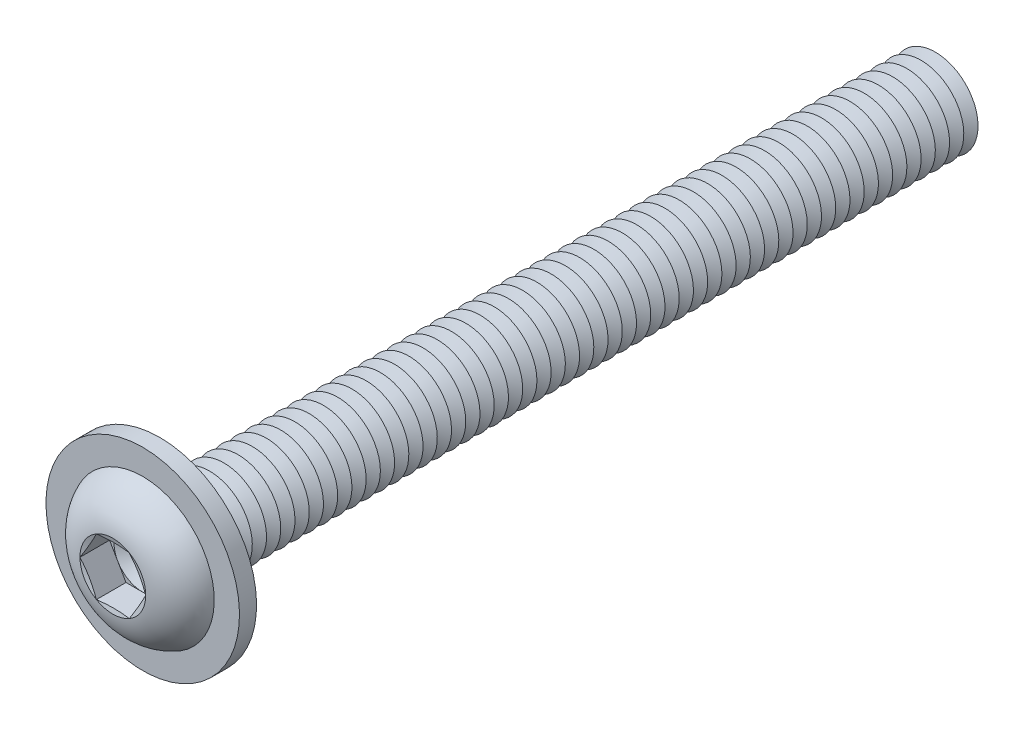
SolidWorks part; units mm, degrees
ref_plane "Front Plane" through (0, 0, 0) normal (0, 0, 1) x (1, 0, 0)
ref_plane "Top Plane" through (0, 0, 0) normal (0, 1, 0) x (1, 0, 0)
ref_plane "Right Plane" through (0, 0, 0) normal (1, 0, 0) x (0, 0, -1)
sketch "Sketch1" plane through (0, 0, 0) normal (1, 0, 0) x (0, 0, -1)
  line L0 (0, 3) -> (0, 5.25)
  line L3 (0, 3) -> (55, 3)
  line L4 (55, 3) -> (55, 0)
  line L5 (55, 0) -> (-3.3, 0) construction
  line L6 (-3.3, 0) -> (55, 0)
  line L7 (-3.3, 2.3094) -> (-3.3, 1.1547) construction
  line L8 (-3.3, 1.1547) -> (-3.3, 0)
  line L9 (-3.3, 2.3094) -> (-2.9906, 1.1547)
  line L10 (-2.9906, 1.1547) -> (-3.3, 1.1547)
  line L11 (55, 0) -> (22.7481, 0) construction
  line L12 (0, 5.25) -> (-3.3, 5.25) construction
  arc A1 (0, 5.25) -> (-3.3, 2.3094) centre (0, 1.928) ccw
  point P8 (55, 1.5)
  dimension "D1" = 10.5
  dimension "D2" = 6
  dimension "D3" = 3.3
  dimension "D4" = 4.6188
  dimension "D5" = 55
  dimension "D6" = 15
revolve "Revolve1" add sketch "Sketch1" angle 360 about L5
fillet "Fillet1" radius 0.5 1 edges at (0, 3, 0)
sketch "Sketch2" plane through (0, 0, 0) normal (1, 0, 0) x (0, 0, -1)
  line L0 (54.5, 3) -> (55.5, 3)
  line L1 (55, 3) -> (0.5, 3) construction
  line L2 (55.5, 3) -> (55, 2.134)
  line L3 (55, -3) -> (55, 3) construction
  line L4 (55, 2.134) -> (54.5, 3)
  dimension "D1" = 1
revolve "Cut-Revolve1" cut sketch "Sketch2" angle 360 about axis through (0, 0, -55) along (0, 0, -1)
pattern_linear "LPattern1" count 55 spacing 1 along (0, 0, 1) of "Cut-Revolve1"
sketch "Sketch3" plane through (0, 0, 3.3) normal (0, 0, 1) x (1, 0, 0)
  line L7 (1.1547, 2) -> (-1.1547, 2)
  line L8 (-1.1547, 2) -> (-2.3094, 0)
  line L9 (-2.3094, 0) -> (-1.1547, -2)
  line L10 (-1.1547, -2) -> (1.1547, -2)
  line L11 (1.1547, -2) -> (2.3094, 0)
  line L12 (2.3094, 0) -> (1.1547, 2)
  circle A0 centre (0, 0) radius 2 construction
  circle A3 centre (0, 0) radius 2.3094 construction
extrude "Cut-Extrude1" cut sketch "Sketch3" against normal blind 2.08
sketch "Sketch4" plane through (0, 0, 1.22) normal (0, 0, 1) x (1, 0, 0)
  line L1 (1.1547, 2) -> (-1.1547, 2) construction
  circle A0 centre (0, 0) radius 2
extrude "Cut-Extrude2" cut sketch "Sketch4" against normal through all draft 60
sketch "Sketch5" plane through (0, 0, 0) normal (0, 0, -1) x (-1, 0, 0)
  circle A0 centre (0, 0) radius 6.8
  circle A1 centre (0, 0) radius 3.5
  circle A2 centre (0, 0) radius 3.5 construction
  dimension "D1" = 13.6
extrude "Boss-Extrude1" add sketch "Sketch5" against normal blind 1.2
